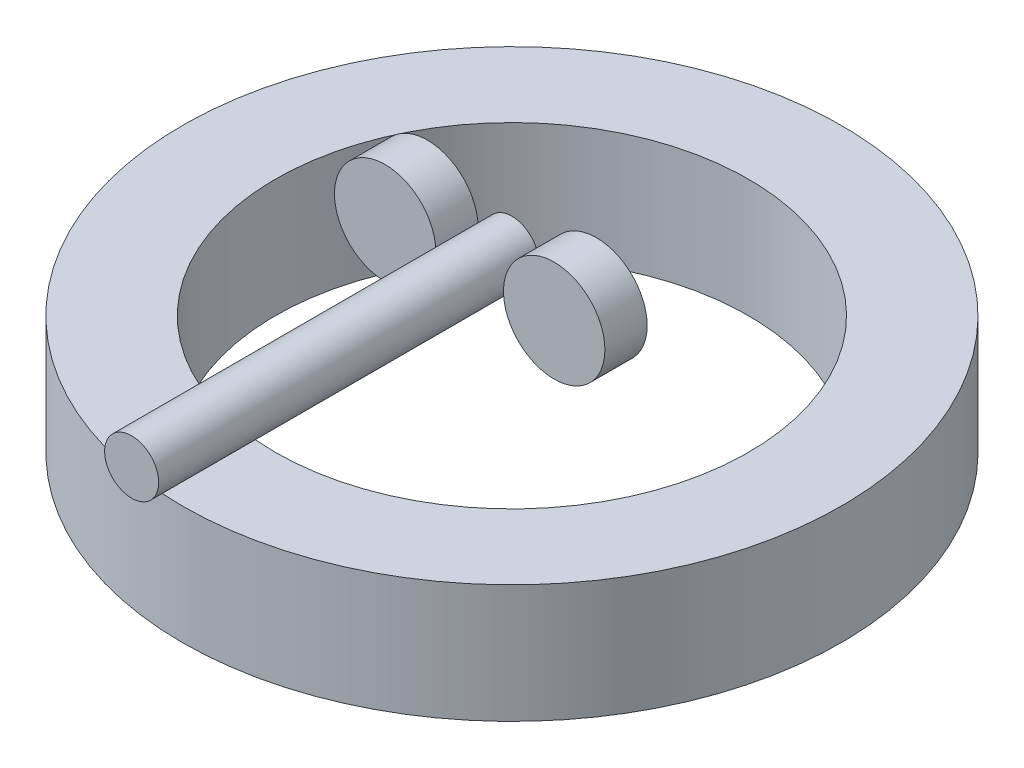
SolidWorks part; units mm, degrees
ref_plane "Front Plane" through (0, 0, 0) normal (0, 0, 1) x (1, 0, 0)
ref_plane "Top Plane" through (0, 0, 0) normal (0, 1, 0) x (1, 0, 0)
ref_plane "Right Plane" through (0, 0, 0) normal (1, 0, 0) x (0, 0, -1)
sketch "Sketch1" plane through (0, 0, 0) normal (0, 1, 0) x (1, 0, 0)
  circle A0 centre (0, 0) radius 9750
  circle A1 centre (0, 0) radius 7000
extrude "Boss-Extrude1" add sketch "Sketch1" against normal blind 3500
sketch "Sketch2" plane through (0, 0, 0) normal (0, 0, 1) x (1, 0, 0)
  circle A0 centre (0, 1750) radius 800
extrude "Boss-Extrude2" add sketch "Sketch2" along normal blind 11250
sketch "Sketch3" plane through (0, 0, 0) normal (0, 1, 0) x (1, 0, 0)
  line L1 (-7000, -2500) -> (-600, -2500)
  line L2 (-7000, -2500) -> (-7000, 2500)
  line L3 (-7000, 2500) -> (-600, 2500)
  line L4 (-600, -2500) -> (-600, 2500)
  line L5 (600, -2500) -> (7000, -2500)
  line L6 (600, -2500) -> (600, 2500)
  line L7 (600, 2500) -> (7000, 2500)
  line L8 (7000, -2500) -> (7000, 2500)
  line L9 (-600, 0) -> (600, 0)
  line L10 (-600, 0) -> (-600, 2500)
  line L11 (-600, 2500) -> (600, 2500)
  line L12 (600, 0) -> (600, 2500)
  line L13 (-600, -2500) -> (600, -2500)
  line L14 (-600, -2500) -> (-600, 0)
  line L15 (-600, 0) -> (600, 0)
  line L16 (600, -2500) -> (600, 0)
sketch "Sketch4" plane through (0, 0, 0) normal (0, 0, 1) x (1, 0, 0)
  circle A0 centre (-2500, 1750) radius 1500
  circle A1 centre (2500, 1750) radius 1500
extrude "Boss-Extrude4" add sketch "Sketch4" along normal blind 1250
